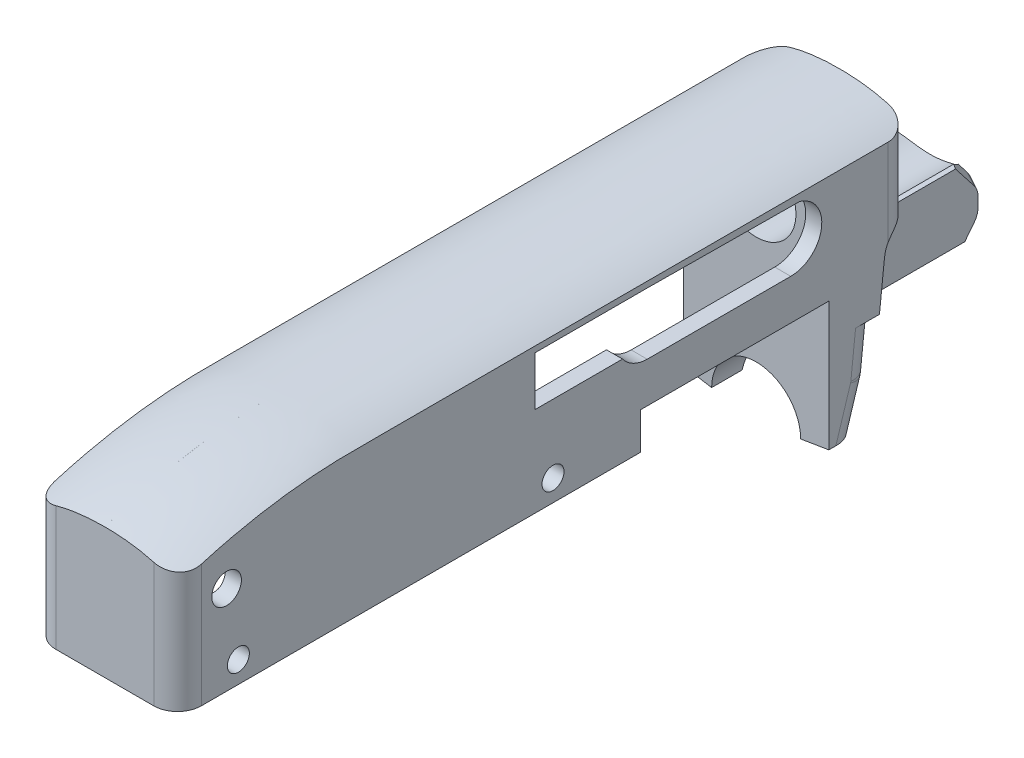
SolidWorks part; units mm, degrees
ref_plane "Front" through (0, 0, 0) normal (0, 0, 1) x (1, 0, 0)
ref_plane "Top" through (0, 0, 0) normal (0, 1, 0) x (1, 0, 0)
ref_plane "Right" through (0, 0, 0) normal (1, 0, 0) x (0, 0, -1)
sketch "Sketch1" plane through (0, 0, 0) normal (1, 0, 0) x (0, 0, -1)
  line L0 (-6.9596, 0) -> (-17.78, 0)
  line L1 (-10.922, -20.701) -> (-17.78, -20.701) construction
  line L2 (0, 15.24) -> (0, 34.29)
  line L3 (0, 34.29) -> (-119.5324, 34.29)
  line L4 (-157.1244, 0) -> (-157.1244, 27.94)
  line L5 (-17.78, 0) -> (-17.78, 7.874)
  line L6 (-17.78, 7.874) -> (-58.0644, 7.874)
  line L7 (-58.0644, 7.874) -> (-58.0644, 0)
  line L8 (-58.0644, 0) -> (-157.1244, 0)
  line L9 (-10.922, -20.701) -> (-6.096, -10.7676) construction
  line L10 (-6.9596, 0) -> (-5.8928, 9.8822)
  line L12 (-17.78, 0) -> (-17.78, -20.701) construction
  line L14 (-6.096, -10.7676) -> (-6.9596, 0) construction
  circle A1 centre (-146.6342, 19.05) radius 3.175
  circle A2 centre (-144.1069, 4.6162) radius 2.3495
  circle A3 centre (-76.7969, 4.6162) radius 2.3495
  spline S0 degree 2 poles (-157.1244, 27.94) (-138.5947, 34.29) (-119.5324, 34.29) knots 0 0 0 1 1 1
  spline S1 degree 2 poles (-5.8928, 9.8822) (-5.3839, 14.5967) (0, 15.24) knots 0 0 0 1 1 1
  point P17 (-5.4864, 15.24)
  dimension "D11" = 10.4902
  dimension "D13" = 6.35
  dimension "D14" = 4.699
  dimension "D16" = 19.05
  dimension "D1" = 157.1244
  dimension "D2" = 99.06
  dimension "D3" = 40.2844
  dimension "D4" = 28.575
  dimension "D5" = 7.874
  dimension "D6" = 6.858
  dimension "D7" = 27.94
  dimension "D8" = 61.468
  dimension "D9" = 6.096
  dimension "D10" = 11.8872
  dimension "D12" = 19.05
  dimension "D15" = 10.8204
  dimension "D17" = 67.31
  dimension "D18" = 13.0175
extrude "Boss-Extrude1" add sketch "Sketch1" along normal blind 31.115 contours S0 L3 L2 S1 L10 L0 L5 L6 L7 L8 L4
sketch "Sketch2" plane through (0, 0, 0) normal (0, -1, 0) x (1, 0, 0)
  line L0 (3.429, 61.4934) -> (3.429, 17.78)
  line L1 (31.115, 17.78) -> (0, 17.78) construction
  line L2 (3.429, 17.78) -> (27.686, 17.78)
  line L3 (27.686, 17.78) -> (27.686, 61.4934)
  line L4 (8.9154, 149.5044) -> (22.1996, 149.5044)
  line L5 (31.115, 157.1244) -> (0, 157.1244) construction
  line L12 (3.429, 153.6954) -> (3.429, 61.4934)
  line L13 (3.429, 61.4934) -> (27.686, 61.4934)
  line L14 (27.686, 61.4934) -> (27.686, 153.6954)
  line L15 (27.686, 153.6954) -> (3.429, 153.6954)
  line L16 (3.429, 144.018) -> (3.429, 61.4934)
  line L18 (27.686, 61.4934) -> (27.686, 144.018)
  arc A0 (22.1996, 149.5044) -> (27.686, 144.018) centre (22.1996, 144.018) cw
  arc A1 (8.9154, 149.5044) -> (3.429, 144.018) centre (8.9154, 144.018) ccw
  dimension "D3" = 5.4864
  dimension "D2" = 7.62
  dimension "D1" = 3.429
extrude "Cut-Extrude1" cut sketch "Sketch2" against normal blind 25.4
sketch "Sketch3" plane through (0, 25.4, 0) normal (0, -1, 0) x (1, 0, 0)
  line L0 (3.429, 89.4286) -> (27.686, 89.4286)
  line L4 (3.429, 17.78) -> (27.686, 17.78)
  line L5 (27.686, 17.78) -> (27.686, 144.018)
  line L6 (22.1996, 149.5044) -> (8.9154, 149.5044)
  line L7 (3.429, 144.018) -> (3.429, 17.78)
  line L8 (3.429, 17.78) -> (27.686, 17.78)
  line L9 (27.686, 17.78) -> (27.686, 89.4286)
  line L11 (3.429, 89.4286) -> (3.429, 17.78)
  arc A2 (27.686, 144.018) -> (22.1996, 149.5044) centre (22.1996, 144.018) ccw
  arc A3 (8.9154, 149.5044) -> (3.429, 144.018) centre (8.9154, 144.018) ccw
  dimension "D1" = 0
extrude "Cut-Extrude2" cut sketch "Sketch3" against normal blind 6.223 contours L11 L8 L9 L0
fillet "Fillet1" radius 5.08 4 edges at (0, 24.765, 0) (31.115, 24.765, 0) (0, 13.97, 157.1244) (31.115, 13.97, 157.1244)
ref_plane "Plane1" through (0, 0, 119.5324) normal (0, 0, 1) x (1, 0, 0)
sketch "Sketch4" plane through (0, 0, 119.5324) normal (0, 0, 1) x (1, 0, 0)
  line L0 (26.035, 27.94) -> (5.08, 27.94) construction
  line L1 (26.035, 27.94) -> (5.08, 27.94) construction
  line L2 (15.5575, 27.94) -> (15.5575, 79.2472) construction
  line L3 (15.5575, 34.29) -> (11.2234, 34.29) construction
  line L4 (31.115, 34.29) -> (0, 34.29) construction
  line L5 (31.115, 29.5586) -> (31.115, 34.29) construction
  line L6 (31.115, 7.874) -> (27.686, 7.874) construction
  line L7 (31.115, 7.874) -> (27.686, 7.874)
  spline S0 degree 2 poles (15.5575, 34.29) (24.6916, 34.29) (31.115, 30.988) knots 0 0 0 1 1 1
  spline S1 degree 2 poles (15.5575, 34.29) (6.4234, 34.29) (0, 30.988) knots 0 0 0 1 1 1
  dimension "D1" = 23.114
sketch "Sketch5" plane through (0, 0, 157.1244) normal (0, 0, 1) x (1, 0, 0)
  line L0 (26.035, 27.94) -> (5.08, 27.94) construction
  line L1 (0, 24.638) -> (31.115, 24.638) construction
  line L2 (31.115, 24.638) -> (31.115, 27.94) construction
  line L3 (31.115, 27.94) -> (15.5575, 27.94) construction
  spline S0 degree 2 poles (15.5575, 27.94) (24.6916, 27.94) (31.115, 24.638) knots 0 0 0 1 1 1
  spline S1 degree 2 poles (15.5575, 27.94) (6.4234, 27.94) (0, 24.638) knots 0 0 0 1 1 1
  dimension "D1" = 31.115
  dimension "D2" = 3.302
  dimension "D3" = 15.5575
sketch "Sketch6" plane through (0, 0, 0) normal (0, 0, -1) x (-1, 0, 0)
  line L0 (-31.115, 30.988) -> (0, 30.988) construction
  line L1 (0, 30.988) -> (0, 34.29) construction
  line L2 (0, 34.29) -> (-15.5575, 34.29) construction
  line L3 (-26.035, 34.29) -> (-5.08, 34.29) construction
  spline S0 degree 2 poles (-15.5575, 34.29) (-6.4234, 34.29) (0, 30.988) knots 0 0 0 1 1 1
  spline S1 degree 2 poles (-15.5575, 34.29) (-24.6916, 34.29) (-31.115, 30.988) knots 0 0 0 1 1 1
  dimension "D1" = 31.115
  dimension "D2" = 3.302
  dimension "D3" = 15.5575
ref_plane "midplane" through (15.5575, 0, 0) normal (1, 0, 0) x (0, 0, -1)
sketch "Sketch7" plane through (15.5575, 0, 0) normal (1, 0, 0) x (0, 0, -1)
  line L0 (-119.5324, 34.29) -> (0, 34.29)
  line L1 (-119.5324, 34.29) -> (0, 34.29) construction
  line L2 (-119.5324, 30.988) -> (0, 30.988)
  parabola Q0
  parabola Q1 construction
  parabola Q2
  dimension "D1" = 2
sketch "Sketch8" plane through (31.115, 0, 0) normal (1, 0, 0) x (0, 0, -1)
  line L0 (-119.5324, 30.988) -> (0, 30.988) construction
  line L1 (-119.5324, 30.988) -> (0, 30.988)
  parabola Q0 construction
  parabola Q1
loft "Cut-Loft2" cut
ref_plane "Plane3" through (26.797, 0, 0) normal (1, 0, 0) x (0, 0, -1)
sketch "Sketch10" plane through (26.797, 0, 0) normal (1, 0, 0) x (0, 0, -1)
  line L0 (0, 14.478) -> (0, 17.1013)
  line L1 (26.5156, 5.969) -> (-22.9805, 5.969) construction
  line L2 (-6.9596, 0) -> (-6.9596, 17.1013)
  line L3 (0, 17.1013) -> (-6.9596, 17.1013)
  line L4 (19.7104, 5.969) -> (19.7104, 8.7561)
  line L5 (0, 14.478) -> (15.24, 14.478)
  line L6 (19.7104, 5.969) -> (19.7104, 3.1819)
  line L7 (19.7104, 8.7561) -> (15.24, 14.478)
  line L8 (19.7104, 3.1819) -> (17.2245, 0)
  line L9 (17.2245, 0) -> (-6.9596, 0)
  line L12 (0, 32.967) -> (0, 15.24) construction
  dimension "D1" = 5.969
  dimension "D2" = 26.67
  dimension "D3" = 142
  dimension "D4" = 142
  dimension "D5" = 15.24
  dimension "D6" = 14.478
extrude "Boss-Extrude2" add sketch "Sketch10" against normal blind 22.479 contours L5 L7 L4 L6 L8 L9 L2 L3 L0
sketch "Sketch11" plane through (31.115, 0, 0) normal (1, 0, 0) x (0, 0, -1)
  line L0 (-17.78, 0) -> (-17.78, -20.701)
  line L1 (-17.78, -20.701) -> (-11.2776, -20.701)
  line L2 (-11.2776, -20.701) -> (-8.0975, -10.541)
  line L3 (-8.0975, -10.541) -> (-6.9596, 0)
  line L4 (-6.9596, 0) -> (-5.8928, 9.8822) construction
  line L5 (-58.0644, 7.874) -> (-17.78, 7.874) construction
  line L6 (-17.78, 0) -> (-6.9596, 0)
  dimension "D1" = 28.575
  dimension "D2" = 10.16
  dimension "D3" = 6.5024
extrude "Boss-Extrude3" add sketch "Sketch11" against normal up to surface (31.115 mm away) separate body contours L0 L1 L2 L3 L6
fillet "Fillet2" radius 6.35 1 edges at (15.5575, -10.541, 8.0975)
fillet "Fillet3" radius 5.08 6 edges at (0, -15.9186, 9.7807) (0, -10.5348, 8.1274) (31.115, -4.9605, 7.4951) (31.115, -10.5348, 8.1274) (0, -4.9605, 7.4951) (31.115, -15.9186, 9.7807)
other "Intersect1"
fillet "Fillet4" radius 5.08 2 edges at (15.5575, 3.1819, -19.7104) (15.5575, 8.7561, -19.7104)
chamfer "Chamfer1" distance 2.54 distance2 1.27 5 edges at (26.797, 0.9017, -17.929) (26.797, 3.2771, -19.4336) (26.797, 5.969, -19.7104) (26.797, 8.6609, -19.4336) (26.797, 12.3063, -16.9367)
chamfer "Chamfer2" distance 1.27 distance2 2.54 5 edges at (4.318, 0.9017, -17.929) (4.318, 3.2771, -19.4336) (4.318, 5.969, -19.7104) (4.318, 8.6609, -19.4336) (4.318, 12.3063, -16.9367)
sketch "Sketch12" plane through (0, 0, 0) normal (0, 0, -1) x (-1, 0, 0)
  line L0 (-15.5575, 18.8595) -> (-15.5575, -18.8595) construction
  circle A0 centre (-15.5575, 20.4597) radius 11.7729
  dimension "D1" = 23.5458
  dimension "D2" = 13.8303
extrude "Cut-Extrude3" cut sketch "Sketch12" along normal through all
sketch "Sketch13" plane through (0, 0, 0) normal (0, 0, -1) x (-1, 0, 0)
  arc A0 (-25.6975, 14.478) -> (-5.4175, 14.478) centre (-15.5575, 20.4597) ccw construction
  arc A1 (-25.6975, 14.478) -> (-5.4175, 14.478) centre (-15.5575, 20.4597) ccw construction
  circle A2 centre (-15.5575, 20.4597) radius 8.509
  dimension "D1" = 17.018
extrude "Cut-Extrude4" cut sketch "Sketch13" against normal blind 25.4 contours A2
sketch "Sketch14" plane through (0, 0, 17.78) normal (0, 0, 1) x (1, 0, 0)
  line L0 (0, -20.701) -> (31.115, -20.701) construction
  line L1 (15.5575, -20.701) -> (15.5575, -4.832) construction
  line L2 (25.0825, -20.701) -> (31.115, -19.701)
  line L3 (31.115, 7.874) -> (31.115, -20.701) construction
  line L4 (6.0325, -20.701) -> (0, -19.701)
  arc A0 (25.0825, -20.701) -> (6.0325, -20.701) centre (15.5575, -20.701) ccw
  dimension "D1" = 19.05
  dimension "D2" = 1
extrude "Cut-Extrude5" cut sketch "Sketch14" against normal through all and the other way through all
sketch "Sketch15" plane through (31.115, 0, 0) normal (1, 0, 0) x (0, 0, -1)
  line L0 (-25.8856, 23.1265) -> (-56.6298, 23.1265) construction
  line L1 (-25.9353, 16.5354) -> (-56.6446, 16.5354)
  line L2 (-23.9957, 29.4411) -> (-56.6298, 29.7176)
  line L3 (-56.6298, 29.7176) -> (-80.6323, 29.7176)
  line L4 (-80.6323, 29.7176) -> (-80.6323, 19.202)
  line L5 (-80.6323, 19.202) -> (-61.9252, 19.202)
  line L6 (-17.78, 7.874) -> (-17.78, -19.701) construction
  line L7 (-58.0644, 0) -> (-58.0644, 7.874) construction
  line L8 (-58.0644, 7.874) -> (-17.78, 7.874) construction
  arc A0 (-25.9353, 16.5354) -> (-23.9957, 29.4411) centre (-25.8856, 23.1265) ccw
  arc A1 (-61.9252, 19.202) -> (-56.6446, 16.5354) centre (-56.6298, 23.1265) ccw
  point P2 (-41.8163, 23.2883)
  point P7 (-19.3675, 22.1469)
  dimension "D1" = 6.5913
  dimension "D2" = 61.2648
  dimension "D3" = 10.5156
  dimension "D4" = 1.5875
  dimension "D5" = 3.8608
  dimension "D6" = 8.6614
extrude "Cut-Extrude6" cut sketch "Sketch15" against normal blind 25.4
sketch "Sketch16" plane through (0, 0, 0) normal (0, -1, 0) x (1, 0, 0)
  line L0 (15.5575, -18.8595) -> (15.5575, 18.8595) construction
  line L1 (25.0825, 17.78) -> (6.0325, 17.78) construction
  circle A0 centre (15.5575, -11.811) radius 2.54
  dimension "D1" = 5.08
  dimension "D2" = 29.591
extrude "Cut-Extrude7" cut sketch "Sketch16" against normal blind 7.9375
sketch "Sketch17" plane through (0, 0, -19.7104) normal (0, 0, -1) x (-1, 0, 0)
  line L0 (-15.5575, 34.29) -> (-15.5575, -20.8841) construction
  line L1 (-15.5575, 34.29) -> (-15.5575, 27.94) construction
  line L2 (-15.5575, 18.8595) -> (-15.5575, -18.8595) construction
  line L3 (-6.858, 0) -> (-24.257, 0) construction
  circle A0 centre (-9.4615, 6.35) radius 2.54
  circle A1 centre (-21.6535, 6.35) radius 2.54
  dimension "D1" = 5.08
  dimension "D2" = 6.35
  dimension "D3" = 6.096
extrude "Cut-Extrude8" cut sketch "Sketch17" against normal blind 25.4
